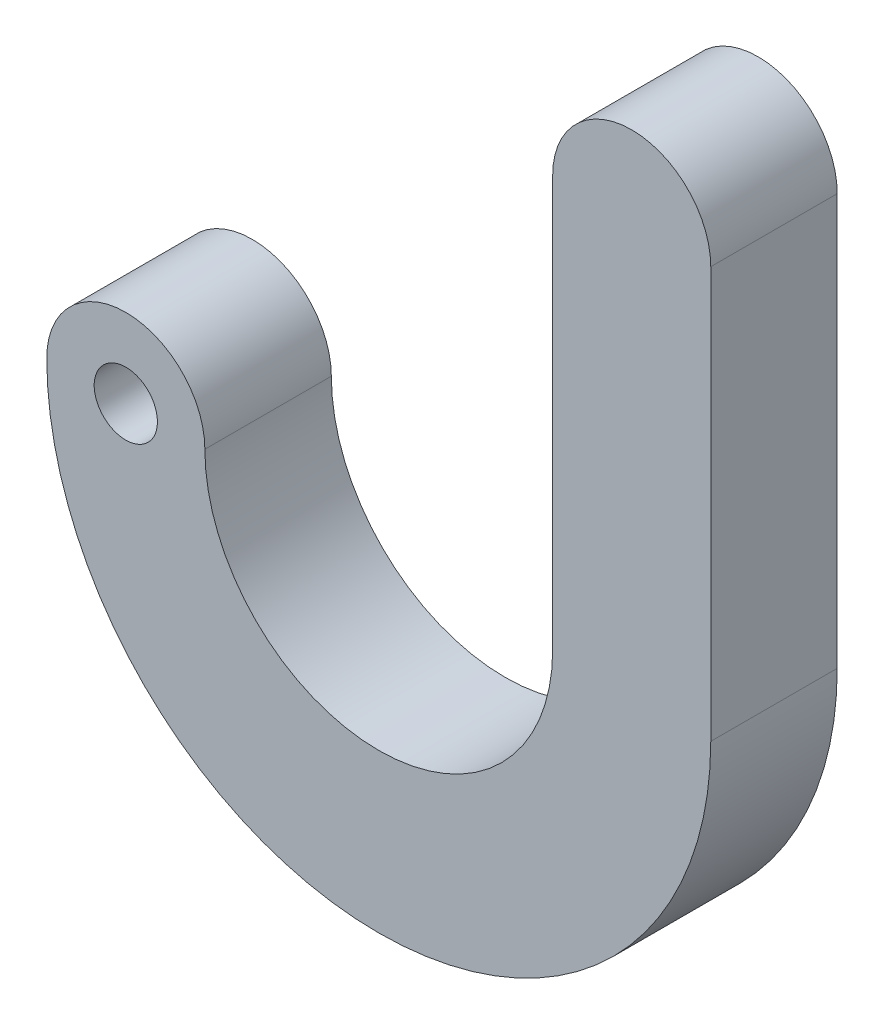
SolidWorks part; units mm, degrees
ref_plane "Alzado" through (0, 0, 0) normal (0, 0, 1) x (1, 0, 0)
ref_plane "Planta" through (0, 0, 0) normal (0, 1, 0) x (1, 0, 0)
ref_plane "Vista lateral" through (0, 0, 0) normal (1, 0, 0) x (0, 0, -1)
sketch "Sketch1" plane through (0, 0, 0) normal (0, 0, 1) x (1, 0, 0)
  line L0 (18.5, 0) -> (18.5, 13)
  line L1 (13.5, 0) -> (13.5, 13)
  circle A0 centre (0, 0) radius 1
  arc A1 (2.5, 0) -> (-2.5, 0) centre (0, 0) ccw
  arc A2 (-2.5, 0) -> (18.5, 0) centre (8, 0) ccw
  arc A3 (2.5, 0) -> (13.5, 0) centre (8, 0) ccw
  arc A4 (18.5, 13) -> (13.5, 13) centre (16, 13) ccw
  dimension "D1" = 2
  dimension "D2" = 5
  dimension "D3" = 21
  dimension "D4" = 13
extrude "Boss-Extrude1" add sketch "Sketch1" along normal blind 4
